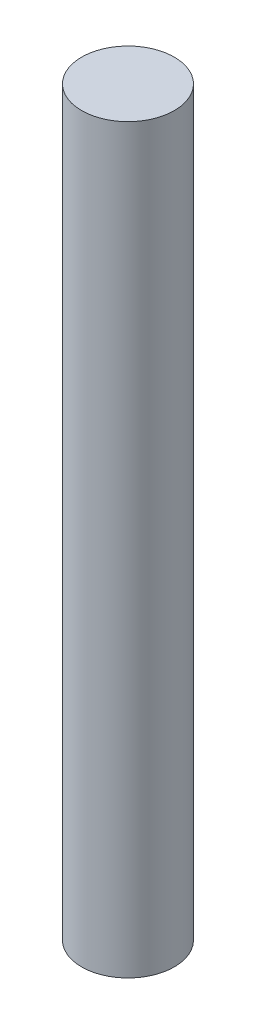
SolidWorks part; units mm, degrees
ref_plane "Front Plane" through (0, 0, 0) normal (0, 0, 1) x (1, 0, 0)
ref_plane "Top Plane" through (0, 0, 0) normal (0, 1, 0) x (1, 0, 0)
ref_plane "Right Plane" through (0, 0, 0) normal (1, 0, 0) x (0, 0, -1)
sketch "Sketch1" plane through (0, 0, 0) normal (0, 1, 0) x (1, 0, 0)
  circle A0 centre (0, 0) radius 3.175
  dimension "D1" = 6.35
extrude "Boss-Extrude1" add sketch "Sketch1" against normal blind 50.8
